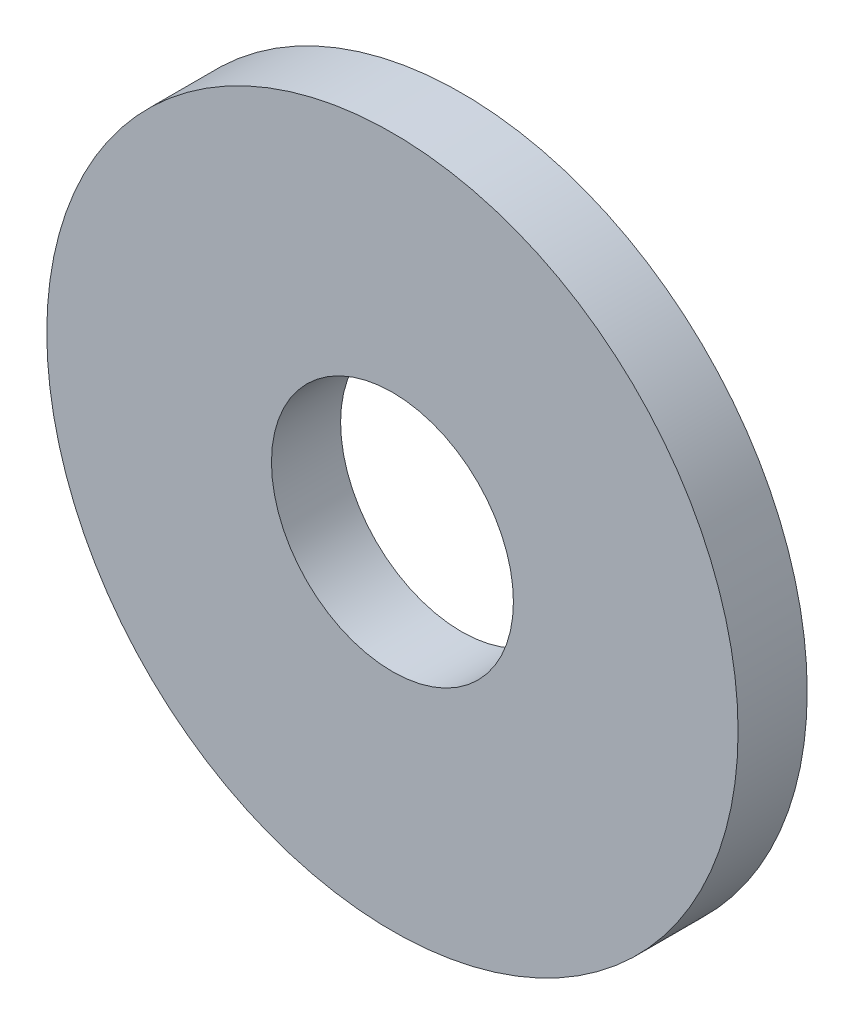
SolidWorks part; units mm, degrees
ref_plane "Plan de face" through (0, 0, 0) normal (0, 0, 1) x (1, 0, 0)
ref_plane "Plan de dessus" through (0, 0, 0) normal (0, 1, 0) x (1, 0, 0)
ref_plane "Plan de droite" through (0, 0, 0) normal (1, 0, 0) x (0, 0, -1)
sketch "Esquisse1" plane through (0, 0, 0) normal (0, 0, 1) x (1, 0, 0)
  circle A0 centre (0, 0) radius 15
  dimension "D1" = 30
extrude "Extrusion1" add sketch "Esquisse1" along normal blind 3
sketch "Esquisse2" plane through (0, 0, 3) normal (0, 0, 1) x (1, 0, 0)
  circle A0 centre (0, 0) radius 5.25
  dimension "D1" = 10.5
extrude "Enlèv. mat.-Extru.1" cut sketch "Esquisse2" against normal through all
